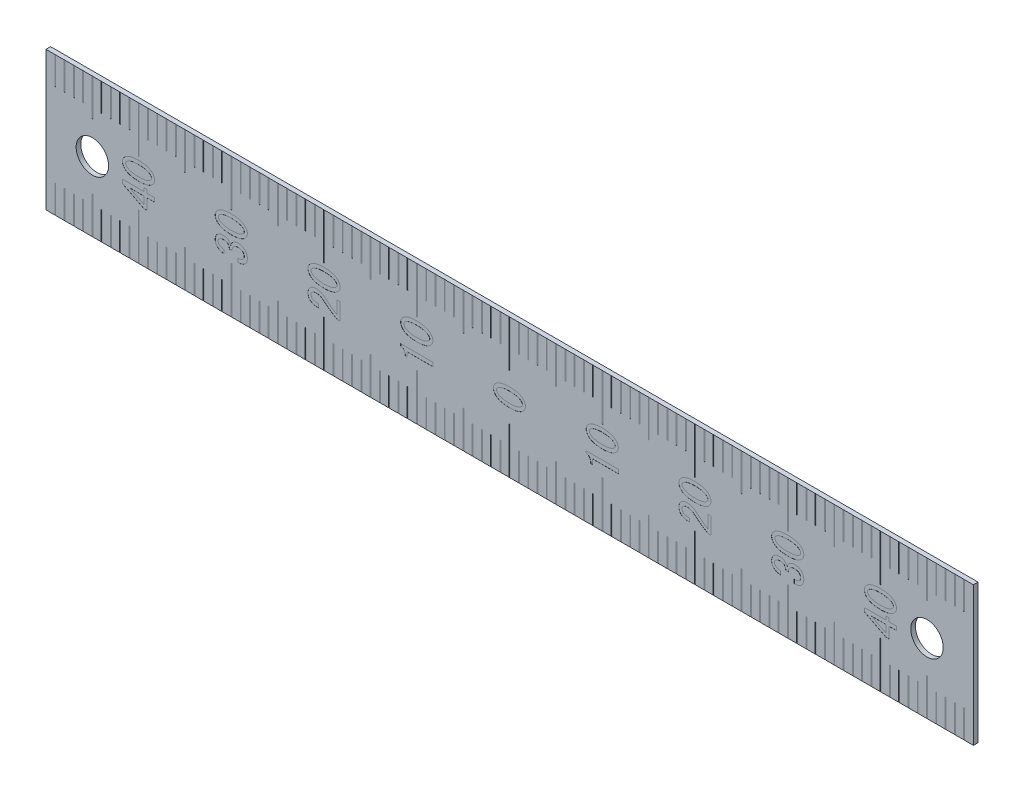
SolidWorks part; units mm, degrees
ref_plane "Front" through (0, 0, 0) normal (0, 0, 1) x (1, 0, 0)
ref_plane "Top" through (0, 0, 0) normal (0, 1, 0) x (1, 0, 0)
ref_plane "Right" through (0, 0, 0) normal (1, 0, 0) x (0, 0, -1)
sketch "Sketch1" plane through (0, 0, 0) normal (0, 0, 1) x (1, 0, 0)
  line L1 (0, -50) -> (0, 50)
  line L2 (0, -50) -> (15, -50)
  line L3 (15, -50) -> (15, 50)
  line L4 (0, 50) -> (15, 50)
  dimension "D1" = 100
  dimension "D2" = 15
extrude "Extrude1" add sketch "Sketch1" along normal blind 0.5
sketch "Sketch2" plane through (0, 0, 0.5) normal (0, 0, 1) x (1, 0, 0)
  line L0 (0, 50) -> (0, -50) construction
  line L1 (0, -50) -> (15, -50) construction
  line L2 (15, 50) -> (0, 50) construction
  circle A0 centre (7.5, -45) radius 1.75
  circle A1 centre (7.5, 45) radius 1.75
  dimension "D1" = 7.5
  dimension "D2" = 7.5
  dimension "D3" = 5
  dimension "D4" = 5
  dimension "D5" = 3.5
  dimension "D6" = 3.5
extrude "Extrude2" cut sketch "Sketch2" against normal through all
sketch "Sketch3" plane through (0, 0, 0.5) normal (0, 0, 1) x (1, 0, 0)
  line L0 (15, 50) -> (0, 50) construction
  line L1 (5.25, 28.25) -> (9.75, 28.25) construction
  line L2 (5.25, 18.25) -> (9.75, 18.25) construction
  line L3 (5.25, 8.25) -> (9.75, 8.25) construction
  line L5 (0, 50) -> (0, -50) construction
  line L6 (6.375, -1.75) -> (10.875, -1.75) construction
  line L7 (5.25, 38.25) -> (9.75, 38.25) construction
  line L8 (5.25, 38.25) -> (5.25, 41.75) construction
  line L9 (7.5, -50) -> (7.5, 50) construction
  line L10 (0, -50) -> (15, -50) construction
  line L11 (0, 40) -> (15, 40) construction
  line L12 (15, -50) -> (15, 50) construction
  line L13 (5.25, 41.75) -> (9.75, 41.75) construction
  line L14 (9.75, 38.25) -> (9.75, 41.75) construction
  line L15 (5.25, 38.25) -> (9.75, 41.75) construction
  line L16 (5.25, 41.75) -> (9.75, 38.25) construction
  line L17 (5.25, -11.75) -> (9.75, -11.75) construction
  line L18 (5.25, -21.75) -> (9.75, -21.75) construction
  line L19 (5.25, -31.75) -> (9.75, -31.75) construction
  line L20 (5.25, -41.75) -> (9.75, -41.75) construction
  circle A0 centre (7.5, 45) radius 1.75 construction
  text T0 "40" font "ＭＳ ゴシック" height 3.5
  text T1 "30" font "ＭＳ ゴシック" height 3.5
  text T2 "20" font "ＭＳ ゴシック" height 3.5
  text T3 "10" font "ＭＳ ゴシック" height 3.5
  text T4 "0"
  text T5 "10"
  text T6 "20"
  text T7 "30"
  text T8 "40"
  point P7 (7.5, 40)
  dimension "D2" = 7.5
  dimension "D1" = 4
  dimension "D3" = 1.125
  dimension "D6" = 10
  dimension "D5" = 4.5
  dimension "D7" = 3.5
extrude "Extrude3" cut sketch "Sketch3" against normal blind 0.01
sketch "Sketch4" plane through (0, 0, 0.5) normal (0, 0, 1) x (1, 0, 0)
  line L0 (15, 40.05) -> (10, 40.05)
  line L1 (15, -50) -> (15, 50) construction
  line L2 (10, 40.05) -> (10, 39.95)
  line L3 (10, 39.95) -> (15, 39.95)
  line L4 (15, 39.95) -> (15, 40.05)
  line L5 (15, 50) -> (0, 50) construction
  line L6 (15, 48.05) -> (15, 47.95)
  line L7 (15, 44.95) -> (11, 44.95)
  line L8 (15, 44.95) -> (15, 45.05)
  line L9 (15, 45.05) -> (11, 45.05)
  line L10 (11, 44.95) -> (11, 45.05)
  line L11 (15, 49.05) -> (12, 49.05)
  line L12 (15, 49.05) -> (15, 48.95)
  line L13 (15, 48.95) -> (12, 48.95)
  line L14 (12, 49.05) -> (12, 48.95)
  line L15 (15, 48.05) -> (12, 48.05)
  line L16 (15, 47.95) -> (12, 47.95)
  line L17 (12, 48.05) -> (12, 47.95)
  line L18 (15, 47.05) -> (15, 46.95)
  line L19 (15, 47.05) -> (12, 47.05)
  line L20 (15, 46.95) -> (12, 46.95)
  line L21 (12, 47.05) -> (12, 46.95)
  line L22 (15, 46.05) -> (15, 45.95)
  line L23 (15, 46.05) -> (12, 46.05)
  line L24 (15, 45.95) -> (12, 45.95)
  line L25 (12, 46.05) -> (12, 45.95)
  line L26 (15, 30.05) -> (10, 30.05)
  line L27 (10, 30.05) -> (10, 29.95)
  line L28 (10, 29.95) -> (15, 29.95)
  line L29 (15, 29.95) -> (15, 30.05)
  line L30 (15, 44.05) -> (15, 43.95)
  line L31 (15, 44.05) -> (12, 44.05)
  line L32 (15, 43.95) -> (12, 43.95)
  line L33 (12, 44.05) -> (12, 43.95)
  line L34 (15, 43.05) -> (15, 42.95)
  line L35 (15, 43.05) -> (12, 43.05)
  line L36 (15, 42.95) -> (12, 42.95)
  line L37 (12, 43.05) -> (12, 42.95)
  line L38 (15, 42.05) -> (15, 41.95)
  line L39 (15, 42.05) -> (12, 42.05)
  line L40 (15, 41.95) -> (12, 41.95)
  line L41 (12, 42.05) -> (12, 41.95)
  line L42 (15, 41.05) -> (15, 40.95)
  line L43 (15, 41.05) -> (12, 41.05)
  line L44 (15, 40.95) -> (12, 40.95)
  line L45 (12, 41.05) -> (12, 40.95)
  line L46 (12, 45.05) -> (12, 44.95)
  line L47 (15, 45.05) -> (12, 45.05)
  line L48 (15, 44.95) -> (12, 44.95)
  line L49 (15, 45.05) -> (15, 44.95)
  line L50 (15, 38.05) -> (15, 37.95)
  line L51 (15, 34.95) -> (11, 34.95)
  line L52 (15, 34.95) -> (15, 35.05)
  line L53 (15, 35.05) -> (11, 35.05)
  line L54 (11, 34.95) -> (11, 35.05)
  line L55 (15, 39.05) -> (12, 39.05)
  line L56 (15, 39.05) -> (15, 38.95)
  line L57 (15, 38.95) -> (12, 38.95)
  line L58 (12, 39.05) -> (12, 38.95)
  line L59 (15, 38.05) -> (12, 38.05)
  line L60 (15, 37.95) -> (12, 37.95)
  line L61 (12, 38.05) -> (12, 37.95)
  line L62 (15, 37.05) -> (15, 36.95)
  line L63 (15, 37.05) -> (12, 37.05)
  line L64 (15, 36.95) -> (12, 36.95)
  line L65 (12, 37.05) -> (12, 36.95)
  line L66 (15, 36.05) -> (15, 35.95)
  line L67 (15, 36.05) -> (12, 36.05)
  line L68 (15, 35.95) -> (12, 35.95)
  line L69 (12, 36.05) -> (12, 35.95)
  line L70 (15, 34.05) -> (15, 33.95)
  line L71 (15, 34.05) -> (12, 34.05)
  line L72 (15, 33.95) -> (12, 33.95)
  line L73 (12, 34.05) -> (12, 33.95)
  line L74 (15, 33.05) -> (15, 32.95)
  line L75 (15, 33.05) -> (12, 33.05)
  line L76 (15, 32.95) -> (12, 32.95)
  line L77 (12, 33.05) -> (12, 32.95)
  line L78 (15, 32.05) -> (15, 31.95)
  line L79 (15, 32.05) -> (12, 32.05)
  line L80 (15, 31.95) -> (12, 31.95)
  line L81 (12, 32.05) -> (12, 31.95)
  line L82 (15, 31.05) -> (15, 30.95)
  line L83 (15, 31.05) -> (12, 31.05)
  line L84 (15, 30.95) -> (12, 30.95)
  line L85 (12, 31.05) -> (12, 30.95)
  line L86 (15, 20.05) -> (10, 20.05)
  line L87 (10, 20.05) -> (10, 19.95)
  line L88 (10, 19.95) -> (15, 19.95)
  line L89 (15, 19.95) -> (15, 20.05)
  line L90 (15, 28.05) -> (15, 27.95)
  line L91 (15, 24.95) -> (11, 24.95)
  line L92 (15, 24.95) -> (15, 25.05)
  line L93 (15, 25.05) -> (11, 25.05)
  line L94 (11, 24.95) -> (11, 25.05)
  line L95 (15, 29.05) -> (12, 29.05)
  line L96 (15, 29.05) -> (15, 28.95)
  line L97 (15, 28.95) -> (12, 28.95)
  line L98 (12, 29.05) -> (12, 28.95)
  line L99 (15, 28.05) -> (12, 28.05)
  line L100 (15, 27.95) -> (12, 27.95)
  line L101 (12, 28.05) -> (12, 27.95)
  line L102 (15, 27.05) -> (15, 26.95)
  line L103 (15, 27.05) -> (12, 27.05)
  line L104 (15, 26.95) -> (12, 26.95)
  line L105 (12, 27.05) -> (12, 26.95)
  line L106 (15, 26.05) -> (15, 25.95)
  line L107 (15, 26.05) -> (12, 26.05)
  line L108 (15, 25.95) -> (12, 25.95)
  line L109 (12, 26.05) -> (12, 25.95)
  line L110 (15, 24.05) -> (15, 23.95)
  line L111 (15, 24.05) -> (12, 24.05)
  line L112 (15, 23.95) -> (12, 23.95)
  line L113 (12, 24.05) -> (12, 23.95)
  line L114 (15, 23.05) -> (15, 22.95)
  line L115 (15, 23.05) -> (12, 23.05)
  line L116 (15, 22.95) -> (12, 22.95)
  line L117 (12, 23.05) -> (12, 22.95)
  line L118 (15, 22.05) -> (15, 21.95)
  line L119 (15, 22.05) -> (12, 22.05)
  line L120 (15, 21.95) -> (12, 21.95)
  line L121 (12, 22.05) -> (12, 21.95)
  line L122 (15, 21.05) -> (15, 20.95)
  line L123 (15, 21.05) -> (12, 21.05)
  line L124 (15, 20.95) -> (12, 20.95)
  line L125 (12, 21.05) -> (12, 20.95)
  line L126 (15, 10.05) -> (10, 10.05)
  line L127 (10, 10.05) -> (10, 9.95)
  line L128 (10, 9.95) -> (15, 9.95)
  line L129 (15, 9.95) -> (15, 10.05)
  line L130 (15, 18.05) -> (15, 17.95)
  line L131 (15, 14.95) -> (11, 14.95)
  line L132 (15, 14.95) -> (15, 15.05)
  line L133 (15, 15.05) -> (11, 15.05)
  line L134 (11, 14.95) -> (11, 15.05)
  line L135 (15, 19.05) -> (12, 19.05)
  line L136 (15, 19.05) -> (15, 18.95)
  line L137 (15, 18.95) -> (12, 18.95)
  line L138 (12, 19.05) -> (12, 18.95)
  line L139 (15, 18.05) -> (12, 18.05)
  line L140 (15, 17.95) -> (12, 17.95)
  line L141 (12, 18.05) -> (12, 17.95)
  line L142 (15, 17.05) -> (15, 16.95)
  line L143 (15, 17.05) -> (12, 17.05)
  line L144 (15, 16.95) -> (12, 16.95)
  line L145 (12, 17.05) -> (12, 16.95)
  line L146 (15, 16.05) -> (15, 15.95)
  line L147 (15, 16.05) -> (12, 16.05)
  line L148 (15, 15.95) -> (12, 15.95)
  line L149 (12, 16.05) -> (12, 15.95)
  line L150 (15, 14.05) -> (15, 13.95)
  line L151 (15, 14.05) -> (12, 14.05)
  line L152 (15, 13.95) -> (12, 13.95)
  line L153 (12, 14.05) -> (12, 13.95)
  line L154 (15, 13.05) -> (15, 12.95)
  line L155 (15, 13.05) -> (12, 13.05)
  line L156 (15, 12.95) -> (12, 12.95)
  line L157 (12, 13.05) -> (12, 12.95)
  line L158 (15, 12.05) -> (15, 11.95)
  line L159 (15, 12.05) -> (12, 12.05)
  line L160 (15, 11.95) -> (12, 11.95)
  line L161 (12, 12.05) -> (12, 11.95)
  line L162 (15, 11.05) -> (15, 10.95)
  line L163 (15, 11.05) -> (12, 11.05)
  line L164 (15, 10.95) -> (12, 10.95)
  line L165 (12, 11.05) -> (12, 10.95)
  line L166 (7.5, 50) -> (7.5, 36.693) construction
  line L167 (3, 1.05) -> (3, 0.95)
  line L168 (0, 0.95) -> (3, 0.95)
  line L169 (0, 1.05) -> (3, 1.05)
  line L170 (15, 8.05) -> (15, 7.95)
  line L171 (15, 4.95) -> (11, 4.95)
  line L172 (15, 4.95) -> (15, 5.05)
  line L173 (15, 5.05) -> (11, 5.05)
  line L174 (11, 4.95) -> (11, 5.05)
  line L175 (15, 9.05) -> (12, 9.05)
  line L176 (15, 9.05) -> (15, 8.95)
  line L177 (15, 8.95) -> (12, 8.95)
  line L178 (12, 9.05) -> (12, 8.95)
  line L179 (15, 8.05) -> (12, 8.05)
  line L180 (15, 7.95) -> (12, 7.95)
  line L181 (12, 8.05) -> (12, 7.95)
  line L182 (15, 7.05) -> (15, 6.95)
  line L183 (15, 7.05) -> (12, 7.05)
  line L184 (15, 6.95) -> (12, 6.95)
  line L185 (12, 7.05) -> (12, 6.95)
  line L186 (15, 6.05) -> (15, 5.95)
  line L187 (15, 6.05) -> (12, 6.05)
  line L188 (15, 5.95) -> (12, 5.95)
  line L189 (12, 6.05) -> (12, 5.95)
  line L190 (15, 4.05) -> (15, 3.95)
  line L191 (15, 4.05) -> (12, 4.05)
  line L192 (15, 3.95) -> (12, 3.95)
  line L193 (12, 4.05) -> (12, 3.95)
  line L194 (15, 3.05) -> (15, 2.95)
  line L195 (15, 3.05) -> (12, 3.05)
  line L196 (15, 2.95) -> (12, 2.95)
  line L197 (12, 3.05) -> (12, 2.95)
  line L198 (15, 2.05) -> (15, 1.95)
  line L199 (15, 2.05) -> (12, 2.05)
  line L200 (15, 1.95) -> (12, 1.95)
  line L201 (12, 2.05) -> (12, 1.95)
  line L202 (15, 1.05) -> (15, 0.95)
  line L203 (15, 1.05) -> (12, 1.05)
  line L204 (15, 0.95) -> (12, 0.95)
  line L205 (12, 1.05) -> (12, 0.95)
  line L206 (15, 0.05) -> (10, 0.05)
  line L207 (10, 0.05) -> (10, -0.05)
  line L208 (10, -0.05) -> (15, -0.05)
  line L209 (15, -0.05) -> (15, 0.05)
  line L210 (0, 1.05) -> (0, 0.95)
  line L211 (3, 2.05) -> (3, 1.95)
  line L212 (0, 1.95) -> (3, 1.95)
  line L213 (0, 2.05) -> (3, 2.05)
  line L214 (0, 2.05) -> (0, 1.95)
  line L215 (3, 3.05) -> (3, 2.95)
  line L216 (0, 2.95) -> (3, 2.95)
  line L217 (0, 3.05) -> (3, 3.05)
  line L218 (0, 3.05) -> (0, 2.95)
  line L219 (3, 4.05) -> (3, 3.95)
  line L220 (0, 3.95) -> (3, 3.95)
  line L221 (0, 4.05) -> (3, 4.05)
  line L222 (0, 4.05) -> (0, 3.95)
  line L223 (3, 6.05) -> (3, 5.95)
  line L224 (0, 5.95) -> (3, 5.95)
  line L225 (0, 6.05) -> (3, 6.05)
  line L226 (0, 6.05) -> (0, 5.95)
  line L227 (3, 7.05) -> (3, 6.95)
  line L228 (0, 6.95) -> (3, 6.95)
  line L229 (0, 7.05) -> (3, 7.05)
  line L230 (0, 7.05) -> (0, 6.95)
  line L231 (3, 8.05) -> (3, 7.95)
  line L232 (0, 7.95) -> (3, 7.95)
  line L233 (0, 8.05) -> (3, 8.05)
  line L234 (3, 9.05) -> (3, 8.95)
  line L235 (0, 8.95) -> (3, 8.95)
  line L236 (0, 9.05) -> (0, 8.95)
  line L237 (0, 9.05) -> (3, 9.05)
  line L238 (4, 4.95) -> (4, 5.05)
  line L239 (0, 5.05) -> (4, 5.05)
  line L240 (0, 4.95) -> (0, 5.05)
  line L241 (0, 4.95) -> (4, 4.95)
  line L242 (0, 8.05) -> (0, 7.95)
  line L243 (3, 11.05) -> (3, 10.95)
  line L244 (0, 10.95) -> (3, 10.95)
  line L245 (0, 11.05) -> (3, 11.05)
  line L246 (0, 11.05) -> (0, 10.95)
  line L247 (3, 12.05) -> (3, 11.95)
  line L248 (0, 11.95) -> (3, 11.95)
  line L249 (0, 12.05) -> (3, 12.05)
  line L250 (0, 12.05) -> (0, 11.95)
  line L251 (3, 13.05) -> (3, 12.95)
  line L252 (0, 12.95) -> (3, 12.95)
  line L253 (0, 13.05) -> (3, 13.05)
  line L254 (0, 13.05) -> (0, 12.95)
  line L255 (3, 14.05) -> (3, 13.95)
  line L256 (0, 13.95) -> (3, 13.95)
  line L257 (0, 14.05) -> (3, 14.05)
  line L258 (0, 14.05) -> (0, 13.95)
  line L259 (3, 16.05) -> (3, 15.95)
  line L260 (0, 15.95) -> (3, 15.95)
  line L261 (0, 16.05) -> (3, 16.05)
  line L262 (0, 16.05) -> (0, 15.95)
  line L263 (3, 17.05) -> (3, 16.95)
  line L264 (0, 16.95) -> (3, 16.95)
  line L265 (0, 17.05) -> (3, 17.05)
  line L266 (0, 17.05) -> (0, 16.95)
  line L267 (3, 18.05) -> (3, 17.95)
  line L268 (0, 17.95) -> (3, 17.95)
  line L269 (0, 18.05) -> (3, 18.05)
  line L270 (3, 19.05) -> (3, 18.95)
  line L271 (0, 18.95) -> (3, 18.95)
  line L272 (0, 19.05) -> (0, 18.95)
  line L273 (0, 19.05) -> (3, 19.05)
  line L274 (4, 14.95) -> (4, 15.05)
  line L275 (0, 15.05) -> (4, 15.05)
  line L276 (0, 14.95) -> (0, 15.05)
  line L277 (0, 14.95) -> (4, 14.95)
  line L278 (0, 18.05) -> (0, 17.95)
  line L279 (0, 9.95) -> (0, 10.05)
  line L280 (5, 9.95) -> (0, 9.95)
  line L281 (5, 10.05) -> (5, 9.95)
  line L282 (0, 10.05) -> (5, 10.05)
  line L283 (3, 21.05) -> (3, 20.95)
  line L284 (0, 20.95) -> (3, 20.95)
  line L285 (0, 21.05) -> (3, 21.05)
  line L286 (0, 21.05) -> (0, 20.95)
  line L287 (3, 22.05) -> (3, 21.95)
  line L288 (0, 21.95) -> (3, 21.95)
  line L289 (0, 22.05) -> (3, 22.05)
  line L290 (0, 22.05) -> (0, 21.95)
  line L291 (3, 23.05) -> (3, 22.95)
  line L292 (0, 22.95) -> (3, 22.95)
  line L293 (0, 23.05) -> (3, 23.05)
  line L294 (0, 23.05) -> (0, 22.95)
  line L295 (3, 24.05) -> (3, 23.95)
  line L296 (0, 23.95) -> (3, 23.95)
  line L297 (0, 24.05) -> (3, 24.05)
  line L298 (0, 24.05) -> (0, 23.95)
  line L299 (3, 26.05) -> (3, 25.95)
  line L300 (0, 25.95) -> (3, 25.95)
  line L301 (0, 26.05) -> (3, 26.05)
  line L302 (0, 26.05) -> (0, 25.95)
  line L303 (3, 27.05) -> (3, 26.95)
  line L304 (0, 26.95) -> (3, 26.95)
  line L305 (0, 27.05) -> (3, 27.05)
  line L306 (0, 27.05) -> (0, 26.95)
  line L307 (3, 28.05) -> (3, 27.95)
  line L308 (0, 27.95) -> (3, 27.95)
  line L309 (0, 28.05) -> (3, 28.05)
  line L310 (3, 29.05) -> (3, 28.95)
  line L311 (0, 28.95) -> (3, 28.95)
  line L312 (0, 29.05) -> (0, 28.95)
  line L313 (0, 29.05) -> (3, 29.05)
  line L314 (4, 24.95) -> (4, 25.05)
  line L315 (0, 25.05) -> (4, 25.05)
  line L316 (0, 24.95) -> (0, 25.05)
  line L317 (0, 24.95) -> (4, 24.95)
  line L318 (0, 28.05) -> (0, 27.95)
  line L319 (0, 19.95) -> (0, 20.05)
  line L320 (5, 19.95) -> (0, 19.95)
  line L321 (5, 20.05) -> (5, 19.95)
  line L322 (0, 20.05) -> (5, 20.05)
  line L323 (3, 31.05) -> (3, 30.95)
  line L324 (0, 30.95) -> (3, 30.95)
  line L325 (0, 31.05) -> (3, 31.05)
  line L326 (0, 31.05) -> (0, 30.95)
  line L327 (3, 32.05) -> (3, 31.95)
  line L328 (0, 31.95) -> (3, 31.95)
  line L329 (0, 32.05) -> (3, 32.05)
  line L330 (0, 32.05) -> (0, 31.95)
  line L331 (3, 33.05) -> (3, 32.95)
  line L332 (0, 32.95) -> (3, 32.95)
  line L333 (0, 33.05) -> (3, 33.05)
  line L334 (0, 33.05) -> (0, 32.95)
  line L335 (3, 34.05) -> (3, 33.95)
  line L336 (0, 33.95) -> (3, 33.95)
  line L337 (0, 34.05) -> (3, 34.05)
  line L338 (0, 34.05) -> (0, 33.95)
  line L339 (3, 36.05) -> (3, 35.95)
  line L340 (0, 35.95) -> (3, 35.95)
  line L341 (0, 36.05) -> (3, 36.05)
  line L342 (0, 36.05) -> (0, 35.95)
  line L343 (3, 37.05) -> (3, 36.95)
  line L344 (0, 36.95) -> (3, 36.95)
  line L345 (0, 37.05) -> (3, 37.05)
  line L346 (0, 37.05) -> (0, 36.95)
  line L347 (3, 38.05) -> (3, 37.95)
  line L348 (0, 37.95) -> (3, 37.95)
  line L349 (0, 38.05) -> (3, 38.05)
  line L350 (3, 39.05) -> (3, 38.95)
  line L351 (0, 38.95) -> (3, 38.95)
  line L352 (0, 39.05) -> (0, 38.95)
  line L353 (0, 39.05) -> (3, 39.05)
  line L354 (4, 34.95) -> (4, 35.05)
  line L355 (0, 35.05) -> (4, 35.05)
  line L356 (0, 34.95) -> (0, 35.05)
  line L357 (0, 34.95) -> (4, 34.95)
  line L358 (0, 38.05) -> (0, 37.95)
  line L359 (3, 41.05) -> (3, 40.95)
  line L360 (0, 40.95) -> (3, 40.95)
  line L361 (0, 41.05) -> (3, 41.05)
  line L362 (0, 41.05) -> (0, 40.95)
  line L363 (3, 42.05) -> (3, 41.95)
  line L364 (0, 41.95) -> (3, 41.95)
  line L365 (0, 42.05) -> (3, 42.05)
  line L366 (0, 42.05) -> (0, 41.95)
  line L367 (3, 43.05) -> (3, 42.95)
  line L368 (0, 42.95) -> (3, 42.95)
  line L369 (0, 43.05) -> (3, 43.05)
  line L370 (0, 43.05) -> (0, 42.95)
  line L371 (3, 44.05) -> (3, 43.95)
  line L372 (0, 43.95) -> (3, 43.95)
  line L373 (0, 44.05) -> (3, 44.05)
  line L374 (0, 44.05) -> (0, 43.95)
  line L375 (0, 29.95) -> (0, 30.05)
  line L376 (5, 29.95) -> (0, 29.95)
  line L377 (5, 30.05) -> (5, 29.95)
  line L378 (0, 30.05) -> (5, 30.05)
  line L379 (3, 46.05) -> (3, 45.95)
  line L380 (0, 45.95) -> (3, 45.95)
  line L381 (0, 46.05) -> (3, 46.05)
  line L382 (0, 46.05) -> (0, 45.95)
  line L383 (3, 47.05) -> (3, 46.95)
  line L384 (0, 46.95) -> (3, 46.95)
  line L385 (0, 47.05) -> (3, 47.05)
  line L386 (0, 47.05) -> (0, 46.95)
  line L387 (3, 48.05) -> (3, 47.95)
  line L388 (0, 47.95) -> (3, 47.95)
  line L389 (0, 48.05) -> (3, 48.05)
  line L390 (3, 49.05) -> (3, 48.95)
  line L391 (0, 48.95) -> (3, 48.95)
  line L392 (0, 49.05) -> (0, 48.95)
  line L393 (0, 49.05) -> (3, 49.05)
  line L394 (4, 44.95) -> (4, 45.05)
  line L395 (0, 45.05) -> (4, 45.05)
  line L396 (0, 44.95) -> (0, 45.05)
  line L397 (0, 44.95) -> (4, 44.95)
  line L398 (0, 48.05) -> (0, 47.95)
  line L399 (0, 39.95) -> (0, 40.05)
  line L400 (5, 39.95) -> (0, 39.95)
  line L401 (5, 40.05) -> (5, 39.95)
  line L402 (0, 40.05) -> (5, 40.05)
  line L403 (15, 0.05) -> (10, 0.05)
  line L404 (10, 0.05) -> (10, -0.05)
  line L405 (10, -0.05) -> (15, -0.05)
  line L406 (15, -0.05) -> (15, 0.05)
  line L407 (3, -8.95) -> (3, -9.05)
  line L408 (0, -9.05) -> (3, -9.05)
  line L409 (0, -8.95) -> (3, -8.95)
  line L410 (15, -1.95) -> (15, -2.05)
  line L411 (15, -5.05) -> (11, -5.05)
  line L412 (15, -5.05) -> (15, -4.95)
  line L413 (15, -4.95) -> (11, -4.95)
  line L414 (11, -5.05) -> (11, -4.95)
  line L415 (15, -0.95) -> (12, -0.95)
  line L416 (15, -0.95) -> (15, -1.05)
  line L417 (15, -1.05) -> (12, -1.05)
  line L418 (12, -0.95) -> (12, -1.05)
  line L419 (15, -1.95) -> (12, -1.95)
  line L420 (15, -2.05) -> (12, -2.05)
  line L421 (12, -1.95) -> (12, -2.05)
  line L422 (15, -2.95) -> (15, -3.05)
  line L423 (15, -2.95) -> (12, -2.95)
  line L424 (15, -3.05) -> (12, -3.05)
  line L425 (12, -2.95) -> (12, -3.05)
  line L426 (15, -3.95) -> (15, -4.05)
  line L427 (15, -3.95) -> (12, -3.95)
  line L428 (15, -4.05) -> (12, -4.05)
  line L429 (12, -3.95) -> (12, -4.05)
  line L430 (15, -5.95) -> (15, -6.05)
  line L431 (15, -5.95) -> (12, -5.95)
  line L432 (15, -6.05) -> (12, -6.05)
  line L433 (12, -5.95) -> (12, -6.05)
  line L434 (15, -6.95) -> (15, -7.05)
  line L435 (15, -6.95) -> (12, -6.95)
  line L436 (15, -7.05) -> (12, -7.05)
  line L437 (12, -6.95) -> (12, -7.05)
  line L438 (15, -7.95) -> (15, -8.05)
  line L439 (15, -7.95) -> (12, -7.95)
  line L440 (15, -8.05) -> (12, -8.05)
  line L441 (12, -7.95) -> (12, -8.05)
  line L442 (15, -8.95) -> (15, -9.05)
  line L443 (15, -8.95) -> (12, -8.95)
  line L444 (15, -9.05) -> (12, -9.05)
  line L445 (12, -8.95) -> (12, -9.05)
  line L446 (0, -8.95) -> (0, -9.05)
  line L447 (3, -7.95) -> (3, -8.05)
  line L448 (0, -8.05) -> (3, -8.05)
  line L449 (0, -7.95) -> (3, -7.95)
  line L450 (0, -7.95) -> (0, -8.05)
  line L451 (3, -6.95) -> (3, -7.05)
  line L452 (0, -7.05) -> (3, -7.05)
  line L453 (0, -6.95) -> (3, -6.95)
  line L454 (0, -6.95) -> (0, -7.05)
  line L455 (3, -5.95) -> (3, -6.05)
  line L456 (0, -6.05) -> (3, -6.05)
  line L457 (0, -5.95) -> (3, -5.95)
  line L458 (0, -5.95) -> (0, -6.05)
  line L459 (3, -3.95) -> (3, -4.05)
  line L460 (0, -4.05) -> (3, -4.05)
  line L461 (0, -3.95) -> (3, -3.95)
  line L462 (0, -3.95) -> (0, -4.05)
  line L463 (3, -2.95) -> (3, -3.05)
  line L464 (0, -3.05) -> (3, -3.05)
  line L465 (0, -2.95) -> (3, -2.95)
  line L466 (0, -2.95) -> (0, -3.05)
  line L467 (3, -1.95) -> (3, -2.05)
  line L468 (0, -2.05) -> (3, -2.05)
  line L469 (0, -1.95) -> (3, -1.95)
  line L470 (3, -0.95) -> (3, -1.05)
  line L471 (0, -1.05) -> (3, -1.05)
  line L472 (0, -0.95) -> (0, -1.05)
  line L473 (0, -0.95) -> (3, -0.95)
  line L474 (4, -5.05) -> (4, -4.95)
  line L475 (0, -4.95) -> (4, -4.95)
  line L476 (0, -5.05) -> (0, -4.95)
  line L477 (0, -5.05) -> (4, -5.05)
  line L478 (0, -1.95) -> (0, -2.05)
  line L479 (0, -0.05) -> (0, 0.05)
  line L480 (5, -0.05) -> (0, -0.05)
  line L481 (5, 0.05) -> (5, -0.05)
  line L482 (0, 0.05) -> (5, 0.05)
  line L483 (15, -9.95) -> (10, -9.95)
  line L484 (10, -9.95) -> (10, -10.05)
  line L485 (10, -10.05) -> (15, -10.05)
  line L486 (15, -10.05) -> (15, -9.95)
  line L487 (3, -18.95) -> (3, -19.05)
  line L488 (0, -19.05) -> (3, -19.05)
  line L489 (0, -18.95) -> (3, -18.95)
  line L490 (15, -11.95) -> (15, -12.05)
  line L491 (15, -15.05) -> (11, -15.05)
  line L492 (15, -15.05) -> (15, -14.95)
  line L493 (15, -14.95) -> (11, -14.95)
  line L494 (11, -15.05) -> (11, -14.95)
  line L495 (15, -10.95) -> (12, -10.95)
  line L496 (15, -10.95) -> (15, -11.05)
  line L497 (15, -11.05) -> (12, -11.05)
  line L498 (12, -10.95) -> (12, -11.05)
  line L499 (15, -11.95) -> (12, -11.95)
  line L500 (15, -12.05) -> (12, -12.05)
  line L501 (12, -11.95) -> (12, -12.05)
  line L502 (15, -12.95) -> (15, -13.05)
  line L503 (15, -12.95) -> (12, -12.95)
  line L504 (15, -13.05) -> (12, -13.05)
  line L505 (12, -12.95) -> (12, -13.05)
  line L506 (15, -13.95) -> (15, -14.05)
  line L507 (15, -13.95) -> (12, -13.95)
  line L508 (15, -14.05) -> (12, -14.05)
  line L509 (12, -13.95) -> (12, -14.05)
  line L510 (15, -15.95) -> (15, -16.05)
  line L511 (15, -15.95) -> (12, -15.95)
  line L512 (15, -16.05) -> (12, -16.05)
  line L513 (12, -15.95) -> (12, -16.05)
  line L514 (15, -16.95) -> (15, -17.05)
  line L515 (15, -16.95) -> (12, -16.95)
  line L516 (15, -17.05) -> (12, -17.05)
  line L517 (12, -16.95) -> (12, -17.05)
  line L518 (15, -17.95) -> (15, -18.05)
  line L519 (15, -17.95) -> (12, -17.95)
  line L520 (15, -18.05) -> (12, -18.05)
  line L521 (12, -17.95) -> (12, -18.05)
  line L522 (15, -18.95) -> (15, -19.05)
  line L523 (15, -18.95) -> (12, -18.95)
  line L524 (15, -19.05) -> (12, -19.05)
  line L525 (12, -18.95) -> (12, -19.05)
  line L526 (0, -18.95) -> (0, -19.05)
  line L527 (3, -17.95) -> (3, -18.05)
  line L528 (0, -18.05) -> (3, -18.05)
  line L529 (0, -17.95) -> (3, -17.95)
  line L530 (0, -17.95) -> (0, -18.05)
  line L531 (3, -16.95) -> (3, -17.05)
  line L532 (0, -17.05) -> (3, -17.05)
  line L533 (0, -16.95) -> (3, -16.95)
  line L534 (0, -16.95) -> (0, -17.05)
  line L535 (3, -15.95) -> (3, -16.05)
  line L536 (0, -16.05) -> (3, -16.05)
  line L537 (0, -15.95) -> (3, -15.95)
  line L538 (0, -15.95) -> (0, -16.05)
  line L539 (3, -13.95) -> (3, -14.05)
  line L540 (0, -14.05) -> (3, -14.05)
  line L541 (0, -13.95) -> (3, -13.95)
  line L542 (0, -13.95) -> (0, -14.05)
  line L543 (3, -12.95) -> (3, -13.05)
  line L544 (0, -13.05) -> (3, -13.05)
  line L545 (0, -12.95) -> (3, -12.95)
  line L546 (0, -12.95) -> (0, -13.05)
  line L547 (3, -11.95) -> (3, -12.05)
  line L548 (0, -12.05) -> (3, -12.05)
  line L549 (0, -11.95) -> (3, -11.95)
  line L550 (3, -10.95) -> (3, -11.05)
  line L551 (0, -11.05) -> (3, -11.05)
  line L552 (0, -10.95) -> (0, -11.05)
  line L553 (0, -10.95) -> (3, -10.95)
  line L554 (4, -15.05) -> (4, -14.95)
  line L555 (0, -14.95) -> (4, -14.95)
  line L556 (0, -15.05) -> (0, -14.95)
  line L557 (0, -15.05) -> (4, -15.05)
  line L558 (0, -11.95) -> (0, -12.05)
  line L559 (0, -10.05) -> (0, -9.95)
  line L560 (5, -10.05) -> (0, -10.05)
  line L561 (5, -9.95) -> (5, -10.05)
  line L562 (0, -9.95) -> (5, -9.95)
  line L563 (15, -19.95) -> (10, -19.95)
  line L564 (10, -19.95) -> (10, -20.05)
  line L565 (10, -20.05) -> (15, -20.05)
  line L566 (15, -20.05) -> (15, -19.95)
  line L567 (3, -28.95) -> (3, -29.05)
  line L568 (0, -29.05) -> (3, -29.05)
  line L569 (0, -28.95) -> (3, -28.95)
  line L570 (15, -21.95) -> (15, -22.05)
  line L571 (15, -25.05) -> (11, -25.05)
  line L572 (15, -25.05) -> (15, -24.95)
  line L573 (15, -24.95) -> (11, -24.95)
  line L574 (11, -25.05) -> (11, -24.95)
  line L575 (15, -20.95) -> (12, -20.95)
  line L576 (15, -20.95) -> (15, -21.05)
  line L577 (15, -21.05) -> (12, -21.05)
  line L578 (12, -20.95) -> (12, -21.05)
  line L579 (15, -21.95) -> (12, -21.95)
  line L580 (15, -22.05) -> (12, -22.05)
  line L581 (12, -21.95) -> (12, -22.05)
  line L582 (15, -22.95) -> (15, -23.05)
  line L583 (15, -22.95) -> (12, -22.95)
  line L584 (15, -23.05) -> (12, -23.05)
  line L585 (12, -22.95) -> (12, -23.05)
  line L586 (15, -23.95) -> (15, -24.05)
  line L587 (15, -23.95) -> (12, -23.95)
  line L588 (15, -24.05) -> (12, -24.05)
  line L589 (12, -23.95) -> (12, -24.05)
  line L590 (15, -25.95) -> (15, -26.05)
  line L591 (15, -25.95) -> (12, -25.95)
  line L592 (15, -26.05) -> (12, -26.05)
  line L593 (12, -25.95) -> (12, -26.05)
  line L594 (15, -26.95) -> (15, -27.05)
  line L595 (15, -26.95) -> (12, -26.95)
  line L596 (15, -27.05) -> (12, -27.05)
  line L597 (12, -26.95) -> (12, -27.05)
  line L598 (15, -27.95) -> (15, -28.05)
  line L599 (15, -27.95) -> (12, -27.95)
  line L600 (15, -28.05) -> (12, -28.05)
  line L601 (12, -27.95) -> (12, -28.05)
  line L602 (15, -28.95) -> (15, -29.05)
  line L603 (15, -28.95) -> (12, -28.95)
  line L604 (15, -29.05) -> (12, -29.05)
  line L605 (12, -28.95) -> (12, -29.05)
  line L606 (0, -28.95) -> (0, -29.05)
  line L607 (3, -27.95) -> (3, -28.05)
  line L608 (0, -28.05) -> (3, -28.05)
  line L609 (0, -27.95) -> (3, -27.95)
  line L610 (0, -27.95) -> (0, -28.05)
  line L611 (3, -26.95) -> (3, -27.05)
  line L612 (0, -27.05) -> (3, -27.05)
  line L613 (0, -26.95) -> (3, -26.95)
  line L614 (0, -26.95) -> (0, -27.05)
  line L615 (3, -25.95) -> (3, -26.05)
  line L616 (0, -26.05) -> (3, -26.05)
  line L617 (0, -25.95) -> (3, -25.95)
  line L618 (0, -25.95) -> (0, -26.05)
  line L619 (3, -23.95) -> (3, -24.05)
  line L620 (0, -24.05) -> (3, -24.05)
  line L621 (0, -23.95) -> (3, -23.95)
  line L622 (0, -23.95) -> (0, -24.05)
  line L623 (3, -22.95) -> (3, -23.05)
  line L624 (0, -23.05) -> (3, -23.05)
  line L625 (0, -22.95) -> (3, -22.95)
  line L626 (0, -22.95) -> (0, -23.05)
  line L627 (3, -21.95) -> (3, -22.05)
  line L628 (0, -22.05) -> (3, -22.05)
  line L629 (0, -21.95) -> (3, -21.95)
  line L630 (3, -20.95) -> (3, -21.05)
  line L631 (0, -21.05) -> (3, -21.05)
  line L632 (0, -20.95) -> (0, -21.05)
  line L633 (0, -20.95) -> (3, -20.95)
  line L634 (4, -25.05) -> (4, -24.95)
  line L635 (0, -24.95) -> (4, -24.95)
  line L636 (0, -25.05) -> (0, -24.95)
  line L637 (0, -25.05) -> (4, -25.05)
  line L638 (0, -21.95) -> (0, -22.05)
  line L639 (0, -20.05) -> (0, -19.95)
  line L640 (5, -20.05) -> (0, -20.05)
  line L641 (5, -19.95) -> (5, -20.05)
  line L642 (0, -19.95) -> (5, -19.95)
  line L643 (15, -29.95) -> (10, -29.95)
  line L644 (10, -29.95) -> (10, -30.05)
  line L645 (10, -30.05) -> (15, -30.05)
  line L646 (15, -30.05) -> (15, -29.95)
  line L647 (3, -38.95) -> (3, -39.05)
  line L648 (0, -39.05) -> (3, -39.05)
  line L649 (0, -38.95) -> (3, -38.95)
  line L650 (15, -31.95) -> (15, -32.05)
  line L651 (15, -35.05) -> (11, -35.05)
  line L652 (15, -35.05) -> (15, -34.95)
  line L653 (15, -34.95) -> (11, -34.95)
  line L654 (11, -35.05) -> (11, -34.95)
  line L655 (15, -30.95) -> (12, -30.95)
  line L656 (15, -30.95) -> (15, -31.05)
  line L657 (15, -31.05) -> (12, -31.05)
  line L658 (12, -30.95) -> (12, -31.05)
  line L659 (15, -31.95) -> (12, -31.95)
  line L660 (15, -32.05) -> (12, -32.05)
  line L661 (12, -31.95) -> (12, -32.05)
  line L662 (15, -32.95) -> (15, -33.05)
  line L663 (15, -32.95) -> (12, -32.95)
  line L664 (15, -33.05) -> (12, -33.05)
  line L665 (12, -32.95) -> (12, -33.05)
  line L666 (15, -33.95) -> (15, -34.05)
  line L667 (15, -33.95) -> (12, -33.95)
  line L668 (15, -34.05) -> (12, -34.05)
  line L669 (12, -33.95) -> (12, -34.05)
  line L670 (15, -35.95) -> (15, -36.05)
  line L671 (15, -35.95) -> (12, -35.95)
  line L672 (15, -36.05) -> (12, -36.05)
  line L673 (12, -35.95) -> (12, -36.05)
  line L674 (15, -36.95) -> (15, -37.05)
  line L675 (15, -36.95) -> (12, -36.95)
  line L676 (15, -37.05) -> (12, -37.05)
  line L677 (12, -36.95) -> (12, -37.05)
  line L678 (15, -37.95) -> (15, -38.05)
  line L679 (15, -37.95) -> (12, -37.95)
  line L680 (15, -38.05) -> (12, -38.05)
  line L681 (12, -37.95) -> (12, -38.05)
  line L682 (15, -38.95) -> (15, -39.05)
  line L683 (15, -38.95) -> (12, -38.95)
  line L684 (15, -39.05) -> (12, -39.05)
  line L685 (12, -38.95) -> (12, -39.05)
  line L686 (0, -38.95) -> (0, -39.05)
  line L687 (3, -37.95) -> (3, -38.05)
  line L688 (0, -38.05) -> (3, -38.05)
  line L689 (0, -37.95) -> (3, -37.95)
  line L690 (0, -37.95) -> (0, -38.05)
  line L691 (3, -36.95) -> (3, -37.05)
  line L692 (0, -37.05) -> (3, -37.05)
  line L693 (0, -36.95) -> (3, -36.95)
  line L694 (0, -36.95) -> (0, -37.05)
  line L695 (3, -35.95) -> (3, -36.05)
  line L696 (0, -36.05) -> (3, -36.05)
  line L697 (0, -35.95) -> (3, -35.95)
  line L698 (0, -35.95) -> (0, -36.05)
  line L699 (3, -33.95) -> (3, -34.05)
  line L700 (0, -34.05) -> (3, -34.05)
  line L701 (0, -33.95) -> (3, -33.95)
  line L702 (0, -33.95) -> (0, -34.05)
  line L703 (3, -32.95) -> (3, -33.05)
  line L704 (0, -33.05) -> (3, -33.05)
  line L705 (0, -32.95) -> (3, -32.95)
  line L706 (0, -32.95) -> (0, -33.05)
  line L707 (3, -31.95) -> (3, -32.05)
  line L708 (0, -32.05) -> (3, -32.05)
  line L709 (0, -31.95) -> (3, -31.95)
  line L710 (3, -30.95) -> (3, -31.05)
  line L711 (0, -31.05) -> (3, -31.05)
  line L712 (0, -30.95) -> (0, -31.05)
  line L713 (0, -30.95) -> (3, -30.95)
  line L714 (4, -35.05) -> (4, -34.95)
  line L715 (0, -34.95) -> (4, -34.95)
  line L716 (0, -35.05) -> (0, -34.95)
  line L717 (0, -35.05) -> (4, -35.05)
  line L718 (0, -31.95) -> (0, -32.05)
  line L719 (0, -30.05) -> (0, -29.95)
  line L720 (5, -30.05) -> (0, -30.05)
  line L721 (5, -29.95) -> (5, -30.05)
  line L722 (0, -29.95) -> (5, -29.95)
  line L723 (15, -39.95) -> (10, -39.95)
  line L724 (10, -39.95) -> (10, -40.05)
  line L725 (10, -40.05) -> (15, -40.05)
  line L726 (15, -40.05) -> (15, -39.95)
  line L727 (3, -48.95) -> (3, -49.05)
  line L728 (0, -49.05) -> (3, -49.05)
  line L729 (0, -48.95) -> (3, -48.95)
  line L730 (15, -41.95) -> (15, -42.05)
  line L731 (15, -45.05) -> (11, -45.05)
  line L732 (15, -45.05) -> (15, -44.95)
  line L733 (15, -44.95) -> (11, -44.95)
  line L734 (11, -45.05) -> (11, -44.95)
  line L735 (15, -40.95) -> (12, -40.95)
  line L736 (15, -40.95) -> (15, -41.05)
  line L737 (15, -41.05) -> (12, -41.05)
  line L738 (12, -40.95) -> (12, -41.05)
  line L739 (15, -41.95) -> (12, -41.95)
  line L740 (15, -42.05) -> (12, -42.05)
  line L741 (12, -41.95) -> (12, -42.05)
  line L742 (15, -42.95) -> (15, -43.05)
  line L743 (15, -42.95) -> (12, -42.95)
  line L744 (15, -43.05) -> (12, -43.05)
  line L745 (12, -42.95) -> (12, -43.05)
  line L746 (15, -43.95) -> (15, -44.05)
  line L747 (15, -43.95) -> (12, -43.95)
  line L748 (15, -44.05) -> (12, -44.05)
  line L749 (12, -43.95) -> (12, -44.05)
  line L750 (15, -45.95) -> (15, -46.05)
  line L751 (15, -45.95) -> (12, -45.95)
  line L752 (15, -46.05) -> (12, -46.05)
  line L753 (12, -45.95) -> (12, -46.05)
  line L754 (15, -46.95) -> (15, -47.05)
  line L755 (15, -46.95) -> (12, -46.95)
  line L756 (15, -47.05) -> (12, -47.05)
  line L757 (12, -46.95) -> (12, -47.05)
  line L758 (15, -47.95) -> (15, -48.05)
  line L759 (15, -47.95) -> (12, -47.95)
  line L760 (15, -48.05) -> (12, -48.05)
  line L761 (12, -47.95) -> (12, -48.05)
  line L762 (15, -48.95) -> (15, -49.05)
  line L763 (15, -48.95) -> (12, -48.95)
  line L764 (15, -49.05) -> (12, -49.05)
  line L765 (12, -48.95) -> (12, -49.05)
  line L766 (0, -48.95) -> (0, -49.05)
  line L767 (3, -47.95) -> (3, -48.05)
  line L768 (0, -48.05) -> (3, -48.05)
  line L769 (0, -47.95) -> (3, -47.95)
  line L770 (0, -47.95) -> (0, -48.05)
  line L771 (3, -46.95) -> (3, -47.05)
  line L772 (0, -47.05) -> (3, -47.05)
  line L773 (0, -46.95) -> (3, -46.95)
  line L774 (0, -46.95) -> (0, -47.05)
  line L775 (3, -45.95) -> (3, -46.05)
  line L776 (0, -46.05) -> (3, -46.05)
  line L777 (0, -45.95) -> (3, -45.95)
  line L778 (0, -45.95) -> (0, -46.05)
  line L779 (3, -43.95) -> (3, -44.05)
  line L780 (0, -44.05) -> (3, -44.05)
  line L781 (0, -43.95) -> (3, -43.95)
  line L782 (0, -43.95) -> (0, -44.05)
  line L783 (3, -42.95) -> (3, -43.05)
  line L784 (0, -43.05) -> (3, -43.05)
  line L785 (0, -42.95) -> (3, -42.95)
  line L786 (0, -42.95) -> (0, -43.05)
  line L787 (3, -41.95) -> (3, -42.05)
  line L788 (0, -42.05) -> (3, -42.05)
  line L789 (0, -41.95) -> (3, -41.95)
  line L790 (3, -40.95) -> (3, -41.05)
  line L791 (0, -41.05) -> (3, -41.05)
  line L792 (0, -40.95) -> (0, -41.05)
  line L793 (0, -40.95) -> (3, -40.95)
  line L794 (4, -45.05) -> (4, -44.95)
  line L795 (0, -44.95) -> (4, -44.95)
  line L796 (0, -45.05) -> (0, -44.95)
  line L797 (0, -45.05) -> (4, -45.05)
  line L798 (0, -41.95) -> (0, -42.05)
  line L799 (0, -40.05) -> (0, -39.95)
  line L800 (5, -40.05) -> (0, -40.05)
  line L801 (5, -39.95) -> (5, -40.05)
  line L802 (0, -39.95) -> (5, -39.95)
  point P4 (15, 40)
  point P13 (15, 45)
  point P18 (15, 49)
  dimension "D1" = 10
  dimension "D2" = 0.1
  dimension "D3" = 5
  dimension "D4" = 5
  dimension "D5" = 0.1
  dimension "D6" = 1
  dimension "D7" = 0.1
  dimension "D8" = 3
  dimension "D9" = 4
  dimension "D12" = 6
  dimension "D10" = 9
  dimension "D11" = 5
extrude "Extrude4" cut sketch "Sketch4" against normal blind 0.01
move or copy body "Body-Move/Copy2" bodies to move or copy 105 copy no rotation origin (0, 0, 0) rotation axis (0, 0, 1) rotation angle 90
move or copy body "Body-Move/Copy3" bodies to move or copy 107 copy no translate (-50, -7.5, 0)
